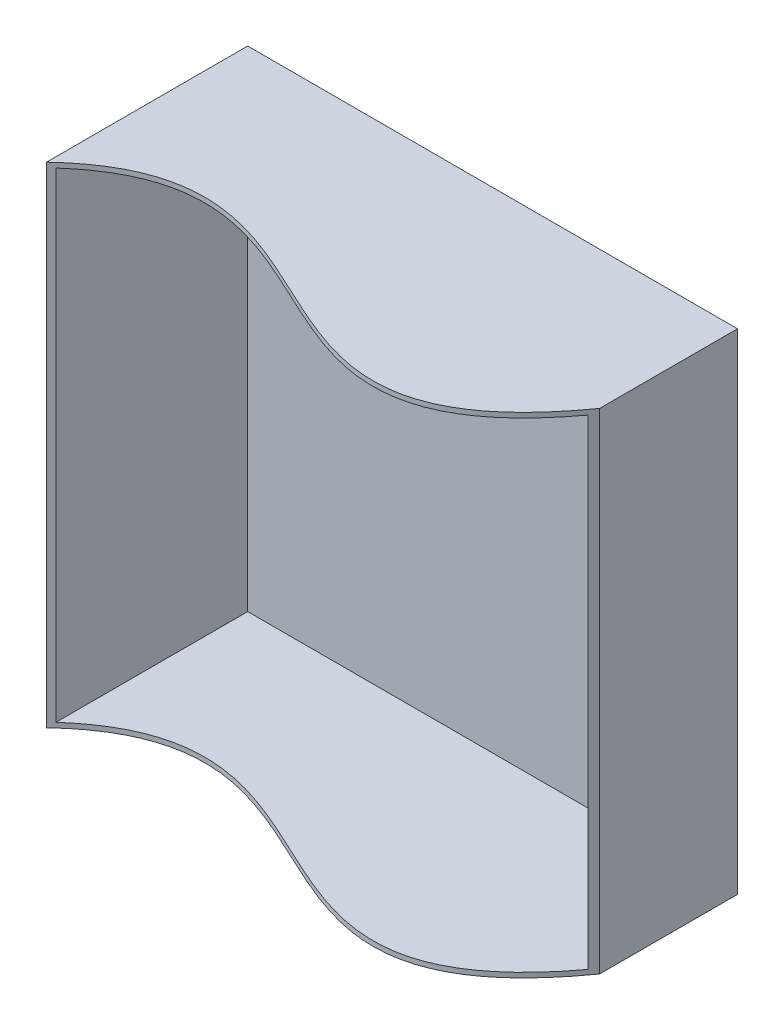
SolidWorks part; units mm, degrees
ref_plane "Ebene vorne" through (0, 0, 0) normal (0, 0, 1) x (1, 0, 0)
ref_plane "Ebene oben" through (0, 0, 0) normal (0, 1, 0) x (1, 0, 0)
ref_plane "Ebene rechts" through (0, 0, 0) normal (1, 0, 0) x (0, 0, -1)
sketch "Skizze1" plane through (0, 0, 0) normal (0, 0, 1) x (1, 0, 0)
  line L1 (-50, -50) -> (50, -50)
  line L2 (-50, -50) -> (-50, 50)
  line L3 (-50, 50) -> (50, 50)
  line L4 (50, -50) -> (50, 50)
  line L5 (-50, -50) -> (50, 50) construction
  line L6 (-50, 50) -> (50, -50) construction
  point P0 (0, 0)
  dimension "D1" = 100
  dimension "D2" = 100
extrude "Aufsatz-Linear austragen1" add sketch "Skizze1" along normal blind 100
shell "Wandung1" thickness 1
sketch "Skizze2" plane through (0, 50, 0) normal (0, 1, 0) x (-1, 0, 0)
  line L0 (50, 100) -> (50, 0) construction
  line L1 (-50, 100) -> (-50, 0) construction
  line L2 (50, 41.0775) -> (50, 100)
  line L3 (50, 100) -> (-50, 100)
  line L4 (-50, 100) -> (-50, 28.1554)
  spline S0 degree 3 poles (50, 41.0775) (13.0364, 6.226) (-14.5301, 77.9415) (-50, 28.1554) knots 0 0 0 0 1 1 1 1
extrude "Schnitt-Linear austragen1" cut sketch "Skizze2" against normal through all
